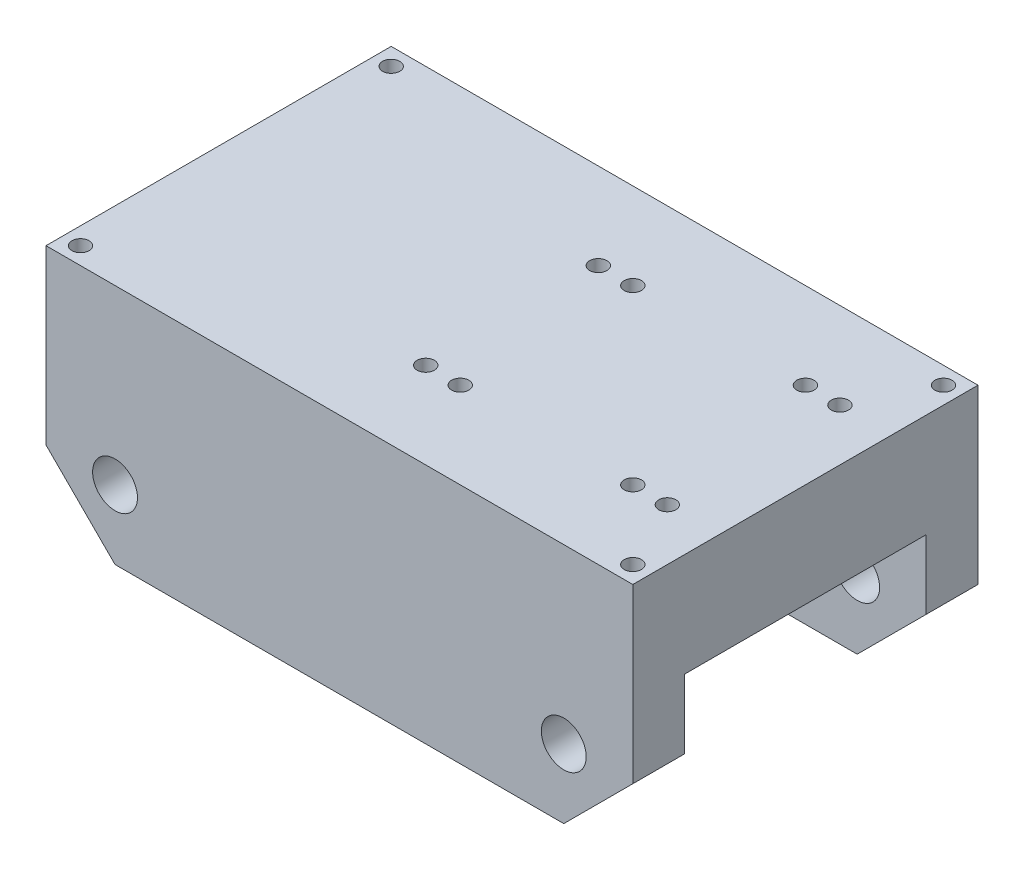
SolidWorks part; units mm, degrees
ref_plane "Plan de face" through (0, 0, 0) normal (0, 0, 1) x (1, 0, 0)
ref_plane "Plan de dessus" through (0, 0, 0) normal (0, 1, 0) x (1, 0, 0)
ref_plane "Plan de droite" through (0, 0, 0) normal (1, 0, 0) x (0, 0, -1)
sketch "Esquisse1" plane through (0, 0, 0) normal (0, 0, 1) x (1, 0, 0)
  line L0 (0, 0) -> (-130, 0)
  line L1 (-130, 0) -> (-150, 20)
  line L2 (-150, 20) -> (-150, 70)
  line L3 (-150, 70) -> (20, 70)
  line L4 (20, 70) -> (20, 20)
  line L5 (20, 20) -> (0, 0)
  circle A0 centre (-130, 20) radius 6.5
  circle A1 centre (0, 20) radius 6.5
  dimension "D7" = 20
  dimension "D8" = 20
  dimension "D9" = 20
  dimension "D10" = 20
  dimension "D11" = 13
  dimension "D1" = 170
  dimension "D2" = 70
  dimension "D3" = 20
  dimension "D4" = 20
  dimension "D5" = 20
  dimension "D6" = 20
extrude "Boss.-Extru.1" add sketch "Esquisse1" along normal blind 100
sketch "Esquisse2" plane through (20, 0, 0) normal (1, 0, 0) x (0, 0, -1)
  line L0 (-100, 20) -> (-100, 70) construction
  line L1 (-85, 40) -> (-15, 40)
  line L2 (-85, 40) -> (-85, -4.52)
  line L3 (-85, -4.52) -> (-15, -4.52)
  line L4 (-15, 40) -> (-15, -4.52)
  line L5 (0, 20) -> (0, 70) construction
  line L6 (-100, 70) -> (0, 70) construction
  dimension "D1" = 15
  dimension "D2" = 15
  dimension "D3" = 30
extrude "Enlèv. mat.-Extru.1" cut sketch "Esquisse2" against normal through all
sketch "Esquisse3" plane through (0, 70, 0) normal (0, 1, 0) x (1, 0, 0)
  line L0 (20, 0) -> (-150, 0) construction
  line L1 (-150, -100) -> (-150, 0) construction
  line L2 (20, -100) -> (20, 0) construction
  line L3 (20, -100) -> (-150, -100) construction
  circle A0 centre (-145, -5) radius 2.5
  circle A1 centre (15, -5) radius 2.5
  circle A2 centre (15, -95) radius 2.5
  circle A3 centre (-145, -95) radius 2.5
  dimension "D1" = 5
  dimension "D2" = 5
  dimension "D3" = 5
  dimension "D4" = 5
  dimension "D5" = 5
  dimension "D6" = 5
  dimension "D7" = 5
  dimension "D8" = 5
  dimension "D9" = 5
extrude "Enlèv. mat.-Extru.2" cut sketch "Esquisse3" against normal blind 8
sketch "Esquisse4" plane through (0, 70, 0) normal (0, 1, 0) x (1, 0, 0)
  line L0 (20, 0) -> (-150, 0) construction
  line L1 (20, -100) -> (-150, -100) construction
  line L2 (20, -100) -> (20, 0) construction
  circle A0 centre (-65, -25) radius 2.5
  circle A1 centre (-65, -75) radius 2.5
  circle A2 centre (-5, -75) radius 2.5
  circle A3 centre (5, -75) radius 2.5
  circle A4 centre (5, -25) radius 2.5
  circle A5 centre (-5, -25) radius 2.5
  circle A6 centre (-55, -25) radius 2.5
  circle A7 centre (-55, -75) radius 2.5
  dimension "D1" = 5
  dimension "D2" = 25
  dimension "D3" = 25
  dimension "D4" = 25
  dimension "D5" = 25
  dimension "D6" = 25
  dimension "D7" = 25
  dimension "D8" = 25
  dimension "D9" = 25
  dimension "D10" = 15
  dimension "D11" = 15
  dimension "D12" = 25
  dimension "D14" = 75
  dimension "D16" = 85
  dimension "D17" = 85
  dimension "D13" = 25
  dimension "D15" = 75
extrude "Enlèv. mat.-Extru.3" cut sketch "Esquisse4" against normal blind 13
